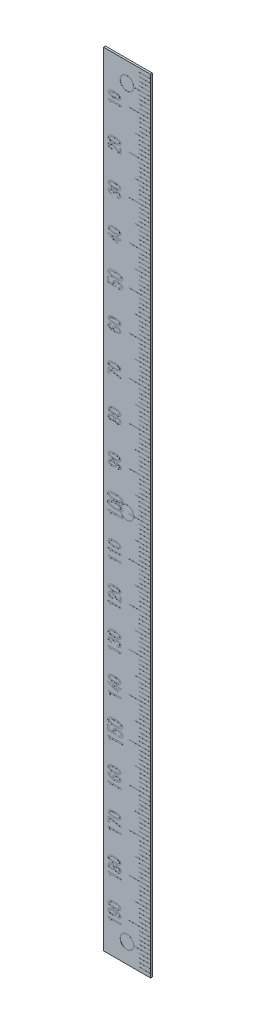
SolidWorks part; units mm, degrees
ref_plane "Front" through (0, 0, 0) normal (0, 0, 1) x (1, 0, 0)
ref_plane "Top" through (0, 0, 0) normal (0, 1, 0) x (1, 0, 0)
ref_plane "Right" through (0, 0, 0) normal (1, 0, 0) x (0, 0, -1)
sketch "Sketch1" plane through (0, 0, 0) normal (0, 0, 1) x (1, 0, 0)
  line L1 (0, 0) -> (0, 200)
  line L2 (0, 0) -> (12, 0)
  line L3 (12, 0) -> (12, 200)
  line L4 (0, 200) -> (12, 200)
  dimension "D1" = 200
  dimension "D2" = 12
extrude "Extrude1" add sketch "Sketch1" along normal blind 0.5
sketch "Sketch2" plane through (0, 0, 0.5) normal (0, 0, 1) x (1, 0, 0)
  line L0 (0, 200) -> (0, 0) construction
  line L1 (0, 0) -> (12, 0) construction
  line L2 (12, 200) -> (0, 200) construction
  circle A0 centre (6, 5) radius 1.75
  circle A1 centre (6, 195) radius 1.75
  circle A2 centre (6, 5) radius 1.65
  circle A3 centre (6, 195) radius 1.65
  circle A4 centre (6, 100) radius 1.75
  circle A5 centre (6, 100) radius 1.65
  dimension "D1" = 6
  dimension "D2" = 6
  dimension "D3" = 5
  dimension "D4" = 5
  dimension "D5" = 3.5
  dimension "D6" = 3.5
  dimension "D7" = 0.1
  dimension "D8" = 2
extrude "Extrude2" cut sketch "Sketch2" against normal blind 0.01
sketch "Sketch3" plane through (0, 0, 0.5) normal (0, 0, 1) x (1, 0, 0)
  line L0 (12, 200) -> (0, 200) construction
  line L1 (1, 188.25) -> (4.5, 188.25) construction
  line L2 (1, 188.25) -> (1, 191.75) construction
  line L3 (1, 191.75) -> (4.5, 191.75) construction
  line L4 (4.5, 188.25) -> (4.5, 191.75) construction
  line L5 (0, 200) -> (0, 0) construction
  line L6 (4.5, 178.25) -> (4.5, 181.75) construction
  line L7 (4.5, 168.25) -> (4.5, 171.75) construction
  line L8 (4.5, 158.25) -> (4.5, 161.75) construction
  line L9 (5, 148.25) -> (5, 151.75) construction
  line L10 (4.5, 138.25) -> (4.5, 141.75) construction
  line L11 (4.5, 128.25) -> (4.5, 131.75) construction
  line L12 (4.5, 118.25) -> (4.5, 121.75) construction
  line L13 (4.5, 108.25) -> (4.5, 111.75) construction
  line L14 (5, 47.2) -> (5, 52.8) construction
  line L15 (4.5, 37.2) -> (4.5, 42.8) construction
  line L16 (12, 0) -> (12, 200) construction
  line L17 (5, 50) -> (-4.9003, 50) construction
  line L18 (4.5, 27.2) -> (4.5, 32.8) construction
  line L19 (4.5, 17.2) -> (4.5, 22.8) construction
  line L20 (4.5, 7.2) -> (4.5, 12.8) construction
  line L21 (5, 97.2) -> (5, 102.8) construction
  line L23 (4.5, 87.2) -> (4.5, 92.8) construction
  line L24 (4.5, 57.2) -> (4.5, 62.8) construction
  line L25 (4.5, 67.2) -> (4.5, 72.8) construction
  line L26 (4.5, 77.2) -> (4.5, 82.8) construction
  text T0 "10" font "ＭＳ ゴシック" height in points 11
  text T1 "20" font "ＭＳ ゴシック" height in points 11
  text T2 "30" font "ＭＳ ゴシック" height in points 11
  text T3 "40" font "ＭＳ ゴシック" height in points 11
  text T4 "50" font "ＭＳ ゴシック" height in points 13
  text T5 "60  " font "ＭＳ ゴシック" height in points 11
  text T6 "70" font "ＭＳ ゴシック" height in points 11
  text T7 "80" font "ＭＳ ゴシック" height in points 11
  text T8 "90" font "ＭＳ ゴシック" height in points 11
  text T9 "150" font "ＭＳ ゴシック" height in points 13
  text T10 "160" font "ＭＳ ゴシック" height in points 11
  text T11 "170" font "ＭＳ ゴシック" height in points 11
  text T12 "180" font "ＭＳ ゴシック" height in points 11
  text T13 "190" font "ＭＳ ゴシック" height in points 11
  text T14 "100" font "ＭＳ ゴシック" height in points 13
  text T15 "110" font "ＭＳ ゴシック" height in points 11
  text T16 "120" font "ＭＳ ゴシック" height in points 11
  text T17 "130" font "ＭＳ ゴシック" height in points 11
  text T18 "140" font "ＭＳ ゴシック" height in points 11
  point P4 (4.5, 190)
  dimension "D1" = 3.5
  dimension "D2" = 10
  dimension "D3" = 1
  dimension "D4" = 3.5
  dimension "D8" = 5.6
  dimension "D6" = 7
  dimension "D7" = 7
  dimension "D9" = 7
  dimension "D5" = 4
  dimension "D11" = 2
extrude "Extrude3" cut sketch "Sketch3" against normal blind 0.01
sketch "Sketch4" plane through (0, 0, 0.5) normal (0, 0, 1) x (1, 0, 0)
  line L0 (12, 190.05) -> (6.5, 190.05)
  line L1 (12, 0) -> (12, 200) construction
  line L2 (6.5, 190.05) -> (6.5, 189.95)
  line L3 (6.5, 189.95) -> (12, 189.95)
  line L4 (12, 189.95) -> (12, 190.05)
  line L5 (12, 200) -> (0, 200) construction
  line L6 (12, 198.05) -> (12, 197.95)
  line L7 (12, 194.95) -> (8, 194.95)
  line L8 (12, 194.95) -> (12, 195.05)
  line L9 (12, 195.05) -> (8, 195.05)
  line L10 (8, 194.95) -> (8, 195.05)
  line L11 (12, 199.05) -> (9, 199.05)
  line L12 (12, 199.05) -> (12, 198.95)
  line L13 (12, 198.95) -> (9, 198.95)
  line L14 (9, 199.05) -> (9, 198.95)
  line L15 (12, 198.05) -> (9, 198.05)
  line L16 (12, 197.95) -> (9, 197.95)
  line L17 (9, 198.05) -> (9, 197.95)
  line L18 (12, 197.05) -> (12, 196.95)
  line L19 (12, 197.05) -> (9, 197.05)
  line L20 (12, 196.95) -> (9, 196.95)
  line L21 (9, 197.05) -> (9, 196.95)
  line L22 (12, 196.05) -> (12, 195.95)
  line L23 (12, 196.05) -> (9, 196.05)
  line L24 (12, 195.95) -> (9, 195.95)
  line L25 (9, 196.05) -> (9, 195.95)
  line L26 (12, 180.05) -> (6.5, 180.05)
  line L27 (6.5, 180.05) -> (6.5, 179.95)
  line L28 (6.5, 179.95) -> (12, 179.95)
  line L29 (12, 179.95) -> (12, 180.05)
  line L30 (12, 194.05) -> (12, 193.95)
  line L31 (12, 194.05) -> (9, 194.05)
  line L32 (12, 193.95) -> (9, 193.95)
  line L33 (9, 194.05) -> (9, 193.95)
  line L34 (12, 193.05) -> (12, 192.95)
  line L35 (12, 193.05) -> (9, 193.05)
  line L36 (12, 192.95) -> (9, 192.95)
  line L37 (9, 193.05) -> (9, 192.95)
  line L38 (12, 192.05) -> (12, 191.95)
  line L39 (12, 192.05) -> (9, 192.05)
  line L40 (12, 191.95) -> (9, 191.95)
  line L41 (9, 192.05) -> (9, 191.95)
  line L42 (12, 191.05) -> (12, 190.95)
  line L43 (12, 191.05) -> (9, 191.05)
  line L44 (12, 190.95) -> (9, 190.95)
  line L45 (9, 191.05) -> (9, 190.95)
  line L46 (9, 195.05) -> (9, 194.95)
  line L47 (12, 195.05) -> (9, 195.05)
  line L48 (12, 194.95) -> (9, 194.95)
  line L49 (12, 195.05) -> (12, 194.95)
  line L50 (12, 188.05) -> (12, 187.95)
  line L51 (12, 184.95) -> (8, 184.95)
  line L52 (12, 184.95) -> (12, 185.05)
  line L53 (12, 185.05) -> (8, 185.05)
  line L54 (8, 184.95) -> (8, 185.05)
  line L55 (12, 189.05) -> (9, 189.05)
  line L56 (12, 189.05) -> (12, 188.95)
  line L57 (12, 188.95) -> (9, 188.95)
  line L58 (9, 189.05) -> (9, 188.95)
  line L59 (12, 188.05) -> (9, 188.05)
  line L60 (12, 187.95) -> (9, 187.95)
  line L61 (9, 188.05) -> (9, 187.95)
  line L62 (12, 187.05) -> (12, 186.95)
  line L63 (12, 187.05) -> (9, 187.05)
  line L64 (12, 186.95) -> (9, 186.95)
  line L65 (9, 187.05) -> (9, 186.95)
  line L66 (12, 186.05) -> (12, 185.95)
  line L67 (12, 186.05) -> (9, 186.05)
  line L68 (12, 185.95) -> (9, 185.95)
  line L69 (9, 186.05) -> (9, 185.95)
  line L70 (12, 184.05) -> (12, 183.95)
  line L71 (12, 184.05) -> (9, 184.05)
  line L72 (12, 183.95) -> (9, 183.95)
  line L73 (9, 184.05) -> (9, 183.95)
  line L74 (12, 183.05) -> (12, 182.95)
  line L75 (12, 183.05) -> (9, 183.05)
  line L76 (12, 182.95) -> (9, 182.95)
  line L77 (9, 183.05) -> (9, 182.95)
  line L78 (12, 182.05) -> (12, 181.95)
  line L79 (12, 182.05) -> (9, 182.05)
  line L80 (12, 181.95) -> (9, 181.95)
  line L81 (9, 182.05) -> (9, 181.95)
  line L82 (12, 181.05) -> (12, 180.95)
  line L83 (12, 181.05) -> (9, 181.05)
  line L84 (12, 180.95) -> (9, 180.95)
  line L85 (9, 181.05) -> (9, 180.95)
  line L86 (12, 170.05) -> (6.5, 170.05)
  line L87 (6.5, 170.05) -> (6.5, 169.95)
  line L88 (6.5, 169.95) -> (12, 169.95)
  line L89 (12, 169.95) -> (12, 170.05)
  line L90 (12, 178.05) -> (12, 177.95)
  line L91 (12, 174.95) -> (8, 174.95)
  line L92 (12, 174.95) -> (12, 175.05)
  line L93 (12, 175.05) -> (8, 175.05)
  line L94 (8, 174.95) -> (8, 175.05)
  line L95 (12, 179.05) -> (9, 179.05)
  line L96 (12, 179.05) -> (12, 178.95)
  line L97 (12, 178.95) -> (9, 178.95)
  line L98 (9, 179.05) -> (9, 178.95)
  line L99 (12, 178.05) -> (9, 178.05)
  line L100 (12, 177.95) -> (9, 177.95)
  line L101 (9, 178.05) -> (9, 177.95)
  line L102 (12, 177.05) -> (12, 176.95)
  line L103 (12, 177.05) -> (9, 177.05)
  line L104 (12, 176.95) -> (9, 176.95)
  line L105 (9, 177.05) -> (9, 176.95)
  line L106 (12, 176.05) -> (12, 175.95)
  line L107 (12, 176.05) -> (9, 176.05)
  line L108 (12, 175.95) -> (9, 175.95)
  line L109 (9, 176.05) -> (9, 175.95)
  line L110 (12, 174.05) -> (12, 173.95)
  line L111 (12, 174.05) -> (9, 174.05)
  line L112 (12, 173.95) -> (9, 173.95)
  line L113 (9, 174.05) -> (9, 173.95)
  line L114 (12, 173.05) -> (12, 172.95)
  line L115 (12, 173.05) -> (9, 173.05)
  line L116 (12, 172.95) -> (9, 172.95)
  line L117 (9, 173.05) -> (9, 172.95)
  line L118 (12, 172.05) -> (12, 171.95)
  line L119 (12, 172.05) -> (9, 172.05)
  line L120 (12, 171.95) -> (9, 171.95)
  line L121 (9, 172.05) -> (9, 171.95)
  line L122 (12, 171.05) -> (12, 170.95)
  line L123 (12, 171.05) -> (9, 171.05)
  line L124 (12, 170.95) -> (9, 170.95)
  line L125 (9, 171.05) -> (9, 170.95)
  line L126 (12, 160.05) -> (6.5, 160.05)
  line L127 (6.5, 160.05) -> (6.5, 159.95)
  line L128 (6.5, 159.95) -> (12, 159.95)
  line L129 (12, 159.95) -> (12, 160.05)
  line L130 (12, 168.05) -> (12, 167.95)
  line L131 (12, 164.95) -> (8, 164.95)
  line L132 (12, 164.95) -> (12, 165.05)
  line L133 (12, 165.05) -> (8, 165.05)
  line L134 (8, 164.95) -> (8, 165.05)
  line L135 (12, 169.05) -> (9, 169.05)
  line L136 (12, 169.05) -> (12, 168.95)
  line L137 (12, 168.95) -> (9, 168.95)
  line L138 (9, 169.05) -> (9, 168.95)
  line L139 (12, 168.05) -> (9, 168.05)
  line L140 (12, 167.95) -> (9, 167.95)
  line L141 (9, 168.05) -> (9, 167.95)
  line L142 (12, 167.05) -> (12, 166.95)
  line L143 (12, 167.05) -> (9, 167.05)
  line L144 (12, 166.95) -> (9, 166.95)
  line L145 (9, 167.05) -> (9, 166.95)
  line L146 (12, 166.05) -> (12, 165.95)
  line L147 (12, 166.05) -> (9, 166.05)
  line L148 (12, 165.95) -> (9, 165.95)
  line L149 (9, 166.05) -> (9, 165.95)
  line L150 (12, 164.05) -> (12, 163.95)
  line L151 (12, 164.05) -> (9, 164.05)
  line L152 (12, 163.95) -> (9, 163.95)
  line L153 (9, 164.05) -> (9, 163.95)
  line L154 (12, 163.05) -> (12, 162.95)
  line L155 (12, 163.05) -> (9, 163.05)
  line L156 (12, 162.95) -> (9, 162.95)
  line L157 (9, 163.05) -> (9, 162.95)
  line L158 (12, 162.05) -> (12, 161.95)
  line L159 (12, 162.05) -> (9, 162.05)
  line L160 (12, 161.95) -> (9, 161.95)
  line L161 (9, 162.05) -> (9, 161.95)
  line L162 (12, 161.05) -> (12, 160.95)
  line L163 (12, 161.05) -> (9, 161.05)
  line L164 (12, 160.95) -> (9, 160.95)
  line L165 (9, 161.05) -> (9, 160.95)
  line L166 (12, 150.05) -> (6.5, 150.05)
  line L167 (6.5, 150.05) -> (6.5, 149.95)
  line L168 (6.5, 149.95) -> (12, 149.95)
  line L169 (12, 149.95) -> (12, 150.05)
  line L170 (12, 158.05) -> (12, 157.95)
  line L171 (12, 154.95) -> (8, 154.95)
  line L172 (12, 154.95) -> (12, 155.05)
  line L173 (12, 155.05) -> (8, 155.05)
  line L174 (8, 154.95) -> (8, 155.05)
  line L175 (12, 159.05) -> (9, 159.05)
  line L176 (12, 159.05) -> (12, 158.95)
  line L177 (12, 158.95) -> (9, 158.95)
  line L178 (9, 159.05) -> (9, 158.95)
  line L179 (12, 158.05) -> (9, 158.05)
  line L180 (12, 157.95) -> (9, 157.95)
  line L181 (9, 158.05) -> (9, 157.95)
  line L182 (12, 157.05) -> (12, 156.95)
  line L183 (12, 157.05) -> (9, 157.05)
  line L184 (12, 156.95) -> (9, 156.95)
  line L185 (9, 157.05) -> (9, 156.95)
  line L186 (12, 156.05) -> (12, 155.95)
  line L187 (12, 156.05) -> (9, 156.05)
  line L188 (12, 155.95) -> (9, 155.95)
  line L189 (9, 156.05) -> (9, 155.95)
  line L190 (12, 154.05) -> (12, 153.95)
  line L191 (12, 154.05) -> (9, 154.05)
  line L192 (12, 153.95) -> (9, 153.95)
  line L193 (9, 154.05) -> (9, 153.95)
  line L194 (12, 153.05) -> (12, 152.95)
  line L195 (12, 153.05) -> (9, 153.05)
  line L196 (12, 152.95) -> (9, 152.95)
  line L197 (9, 153.05) -> (9, 152.95)
  line L198 (12, 152.05) -> (12, 151.95)
  line L199 (12, 152.05) -> (9, 152.05)
  line L200 (12, 151.95) -> (9, 151.95)
  line L201 (9, 152.05) -> (9, 151.95)
  line L202 (12, 151.05) -> (12, 150.95)
  line L203 (12, 151.05) -> (9, 151.05)
  line L204 (12, 150.95) -> (9, 150.95)
  line L205 (9, 151.05) -> (9, 150.95)
  line L206 (12, 150.05) -> (6.5, 150.05)
  line L207 (6.5, 150.05) -> (6.5, 149.95)
  line L208 (6.5, 149.95) -> (12, 149.95)
  line L209 (12, 149.95) -> (12, 150.05)
  line L210 (12, 148.05) -> (12, 147.95)
  line L211 (12, 144.95) -> (8, 144.95)
  line L212 (12, 144.95) -> (12, 145.05)
  line L213 (12, 145.05) -> (8, 145.05)
  line L214 (8, 144.95) -> (8, 145.05)
  line L215 (12, 149.05) -> (9, 149.05)
  line L216 (12, 149.05) -> (12, 148.95)
  line L217 (12, 148.95) -> (9, 148.95)
  line L218 (9, 149.05) -> (9, 148.95)
  line L219 (12, 148.05) -> (9, 148.05)
  line L220 (12, 147.95) -> (9, 147.95)
  line L221 (9, 148.05) -> (9, 147.95)
  line L222 (12, 147.05) -> (12, 146.95)
  line L223 (12, 147.05) -> (9, 147.05)
  line L224 (12, 146.95) -> (9, 146.95)
  line L225 (9, 147.05) -> (9, 146.95)
  line L226 (12, 146.05) -> (12, 145.95)
  line L227 (12, 146.05) -> (9, 146.05)
  line L228 (12, 145.95) -> (9, 145.95)
  line L229 (9, 146.05) -> (9, 145.95)
  line L230 (12, 144.05) -> (12, 143.95)
  line L231 (12, 144.05) -> (9, 144.05)
  line L232 (12, 143.95) -> (9, 143.95)
  line L233 (9, 144.05) -> (9, 143.95)
  line L234 (12, 143.05) -> (12, 142.95)
  line L235 (12, 143.05) -> (9, 143.05)
  line L236 (12, 142.95) -> (9, 142.95)
  line L237 (9, 143.05) -> (9, 142.95)
  line L238 (12, 142.05) -> (12, 141.95)
  line L239 (12, 142.05) -> (9, 142.05)
  line L240 (12, 141.95) -> (9, 141.95)
  line L241 (9, 142.05) -> (9, 141.95)
  line L242 (12, 141.05) -> (12, 140.95)
  line L243 (12, 141.05) -> (9, 141.05)
  line L244 (12, 140.95) -> (9, 140.95)
  line L245 (9, 141.05) -> (9, 140.95)
  line L246 (12, 140.05) -> (6.5, 140.05)
  line L247 (6.5, 140.05) -> (6.5, 139.95)
  line L248 (6.5, 139.95) -> (12, 139.95)
  line L249 (12, 139.95) -> (12, 140.05)
  line L250 (12, 138.05) -> (12, 137.95)
  line L251 (12, 134.95) -> (8, 134.95)
  line L252 (12, 134.95) -> (12, 135.05)
  line L253 (12, 135.05) -> (8, 135.05)
  line L254 (8, 134.95) -> (8, 135.05)
  line L255 (12, 139.05) -> (9, 139.05)
  line L256 (12, 139.05) -> (12, 138.95)
  line L257 (12, 138.95) -> (9, 138.95)
  line L258 (9, 139.05) -> (9, 138.95)
  line L259 (12, 138.05) -> (9, 138.05)
  line L260 (12, 137.95) -> (9, 137.95)
  line L261 (9, 138.05) -> (9, 137.95)
  line L262 (12, 137.05) -> (12, 136.95)
  line L263 (12, 137.05) -> (9, 137.05)
  line L264 (12, 136.95) -> (9, 136.95)
  line L265 (9, 137.05) -> (9, 136.95)
  line L266 (12, 136.05) -> (12, 135.95)
  line L267 (12, 136.05) -> (9, 136.05)
  line L268 (12, 135.95) -> (9, 135.95)
  line L269 (9, 136.05) -> (9, 135.95)
  line L270 (12, 134.05) -> (12, 133.95)
  line L271 (12, 134.05) -> (9, 134.05)
  line L272 (12, 133.95) -> (9, 133.95)
  line L273 (9, 134.05) -> (9, 133.95)
  line L274 (12, 133.05) -> (12, 132.95)
  line L275 (12, 133.05) -> (9, 133.05)
  line L276 (12, 132.95) -> (9, 132.95)
  line L277 (9, 133.05) -> (9, 132.95)
  line L278 (12, 132.05) -> (12, 131.95)
  line L279 (12, 132.05) -> (9, 132.05)
  line L280 (12, 131.95) -> (9, 131.95)
  line L281 (9, 132.05) -> (9, 131.95)
  line L282 (12, 131.05) -> (12, 130.95)
  line L283 (12, 131.05) -> (9, 131.05)
  line L284 (12, 130.95) -> (9, 130.95)
  line L285 (9, 131.05) -> (9, 130.95)
  line L286 (12, 130.05) -> (6.5, 130.05)
  line L287 (6.5, 130.05) -> (6.5, 129.95)
  line L288 (6.5, 129.95) -> (12, 129.95)
  line L289 (12, 129.95) -> (12, 130.05)
  line L290 (12, 128.05) -> (12, 127.95)
  line L291 (12, 124.95) -> (8, 124.95)
  line L292 (12, 124.95) -> (12, 125.05)
  line L293 (12, 125.05) -> (8, 125.05)
  line L294 (8, 124.95) -> (8, 125.05)
  line L295 (12, 129.05) -> (9, 129.05)
  line L296 (12, 129.05) -> (12, 128.95)
  line L297 (12, 128.95) -> (9, 128.95)
  line L298 (9, 129.05) -> (9, 128.95)
  line L299 (12, 128.05) -> (9, 128.05)
  line L300 (12, 127.95) -> (9, 127.95)
  line L301 (9, 128.05) -> (9, 127.95)
  line L302 (12, 127.05) -> (12, 126.95)
  line L303 (12, 127.05) -> (9, 127.05)
  line L304 (12, 126.95) -> (9, 126.95)
  line L305 (9, 127.05) -> (9, 126.95)
  line L306 (12, 126.05) -> (12, 125.95)
  line L307 (12, 126.05) -> (9, 126.05)
  line L308 (12, 125.95) -> (9, 125.95)
  line L309 (9, 126.05) -> (9, 125.95)
  line L310 (12, 124.05) -> (12, 123.95)
  line L311 (12, 124.05) -> (9, 124.05)
  line L312 (12, 123.95) -> (9, 123.95)
  line L313 (9, 124.05) -> (9, 123.95)
  line L314 (12, 123.05) -> (12, 122.95)
  line L315 (12, 123.05) -> (9, 123.05)
  line L316 (12, 122.95) -> (9, 122.95)
  line L317 (9, 123.05) -> (9, 122.95)
  line L318 (12, 122.05) -> (12, 121.95)
  line L319 (12, 122.05) -> (9, 122.05)
  line L320 (12, 121.95) -> (9, 121.95)
  line L321 (9, 122.05) -> (9, 121.95)
  line L322 (12, 121.05) -> (12, 120.95)
  line L323 (12, 121.05) -> (9, 121.05)
  line L324 (12, 120.95) -> (9, 120.95)
  line L325 (9, 121.05) -> (9, 120.95)
  line L326 (12, 120.05) -> (6.5, 120.05)
  line L327 (6.5, 120.05) -> (6.5, 119.95)
  line L328 (6.5, 119.95) -> (12, 119.95)
  line L329 (12, 119.95) -> (12, 120.05)
  line L330 (12, 118.05) -> (12, 117.95)
  line L331 (12, 114.95) -> (8, 114.95)
  line L332 (12, 114.95) -> (12, 115.05)
  line L333 (12, 115.05) -> (8, 115.05)
  line L334 (8, 114.95) -> (8, 115.05)
  line L335 (12, 119.05) -> (9, 119.05)
  line L336 (12, 119.05) -> (12, 118.95)
  line L337 (12, 118.95) -> (9, 118.95)
  line L338 (9, 119.05) -> (9, 118.95)
  line L339 (12, 118.05) -> (9, 118.05)
  line L340 (12, 117.95) -> (9, 117.95)
  line L341 (9, 118.05) -> (9, 117.95)
  line L342 (12, 117.05) -> (12, 116.95)
  line L343 (12, 117.05) -> (9, 117.05)
  line L344 (12, 116.95) -> (9, 116.95)
  line L345 (9, 117.05) -> (9, 116.95)
  line L346 (12, 116.05) -> (12, 115.95)
  line L347 (12, 116.05) -> (9, 116.05)
  line L348 (12, 115.95) -> (9, 115.95)
  line L349 (9, 116.05) -> (9, 115.95)
  line L350 (12, 114.05) -> (12, 113.95)
  line L351 (12, 114.05) -> (9, 114.05)
  line L352 (12, 113.95) -> (9, 113.95)
  line L353 (9, 114.05) -> (9, 113.95)
  line L354 (12, 113.05) -> (12, 112.95)
  line L355 (12, 113.05) -> (9, 113.05)
  line L356 (12, 112.95) -> (9, 112.95)
  line L357 (9, 113.05) -> (9, 112.95)
  line L358 (12, 112.05) -> (12, 111.95)
  line L359 (12, 112.05) -> (9, 112.05)
  line L360 (12, 111.95) -> (9, 111.95)
  line L361 (9, 112.05) -> (9, 111.95)
  line L362 (12, 111.05) -> (12, 110.95)
  line L363 (12, 111.05) -> (9, 111.05)
  line L364 (12, 110.95) -> (9, 110.95)
  line L365 (9, 111.05) -> (9, 110.95)
  line L366 (12, 110.05) -> (6.5, 110.05)
  line L367 (6.5, 110.05) -> (6.5, 109.95)
  line L368 (6.5, 109.95) -> (12, 109.95)
  line L369 (12, 109.95) -> (12, 110.05)
  line L370 (12, 108.05) -> (12, 107.95)
  line L371 (12, 104.95) -> (8, 104.95)
  line L372 (12, 104.95) -> (12, 105.05)
  line L373 (12, 105.05) -> (8, 105.05)
  line L374 (8, 104.95) -> (8, 105.05)
  line L375 (12, 109.05) -> (9, 109.05)
  line L376 (12, 109.05) -> (12, 108.95)
  line L377 (12, 108.95) -> (9, 108.95)
  line L378 (9, 109.05) -> (9, 108.95)
  line L379 (12, 108.05) -> (9, 108.05)
  line L380 (12, 107.95) -> (9, 107.95)
  line L381 (9, 108.05) -> (9, 107.95)
  line L382 (12, 107.05) -> (12, 106.95)
  line L383 (12, 107.05) -> (9, 107.05)
  line L384 (12, 106.95) -> (9, 106.95)
  line L385 (9, 107.05) -> (9, 106.95)
  line L386 (12, 106.05) -> (12, 105.95)
  line L387 (12, 106.05) -> (9, 106.05)
  line L388 (12, 105.95) -> (9, 105.95)
  line L389 (9, 106.05) -> (9, 105.95)
  line L390 (12, 104.05) -> (12, 103.95)
  line L391 (12, 104.05) -> (9, 104.05)
  line L392 (12, 103.95) -> (9, 103.95)
  line L393 (9, 104.05) -> (9, 103.95)
  line L394 (12, 103.05) -> (12, 102.95)
  line L395 (12, 103.05) -> (9, 103.05)
  line L396 (12, 102.95) -> (9, 102.95)
  line L397 (9, 103.05) -> (9, 102.95)
  line L398 (12, 102.05) -> (12, 101.95)
  line L399 (12, 102.05) -> (9, 102.05)
  line L400 (12, 101.95) -> (9, 101.95)
  line L401 (9, 102.05) -> (9, 101.95)
  line L402 (12, 101.05) -> (12, 100.95)
  line L403 (12, 101.05) -> (9, 101.05)
  line L404 (12, 100.95) -> (9, 100.95)
  line L405 (9, 101.05) -> (9, 100.95)
  line L406 (12, 100.05) -> (6.5, 100.05)
  line L407 (6.5, 100.05) -> (6.5, 99.95)
  line L408 (6.5, 99.95) -> (12, 99.95)
  line L409 (12, 99.95) -> (12, 100.05)
  line L410 (12, 98.05) -> (12, 97.95)
  line L411 (12, 94.95) -> (8, 94.95)
  line L412 (12, 94.95) -> (12, 95.05)
  line L413 (12, 95.05) -> (8, 95.05)
  line L414 (8, 94.95) -> (8, 95.05)
  line L415 (12, 99.05) -> (9, 99.05)
  line L416 (12, 99.05) -> (12, 98.95)
  line L417 (12, 98.95) -> (9, 98.95)
  line L418 (9, 99.05) -> (9, 98.95)
  line L419 (12, 98.05) -> (9, 98.05)
  line L420 (12, 97.95) -> (9, 97.95)
  line L421 (9, 98.05) -> (9, 97.95)
  line L422 (12, 97.05) -> (12, 96.95)
  line L423 (12, 97.05) -> (9, 97.05)
  line L424 (12, 96.95) -> (9, 96.95)
  line L425 (9, 97.05) -> (9, 96.95)
  line L426 (12, 96.05) -> (12, 95.95)
  line L427 (12, 96.05) -> (9, 96.05)
  line L428 (12, 95.95) -> (9, 95.95)
  line L429 (9, 96.05) -> (9, 95.95)
  line L430 (12, 94.05) -> (12, 93.95)
  line L431 (12, 94.05) -> (9, 94.05)
  line L432 (12, 93.95) -> (9, 93.95)
  line L433 (9, 94.05) -> (9, 93.95)
  line L434 (12, 93.05) -> (12, 92.95)
  line L435 (12, 93.05) -> (9, 93.05)
  line L436 (12, 92.95) -> (9, 92.95)
  line L437 (9, 93.05) -> (9, 92.95)
  line L438 (12, 92.05) -> (12, 91.95)
  line L439 (12, 92.05) -> (9, 92.05)
  line L440 (12, 91.95) -> (9, 91.95)
  line L441 (9, 92.05) -> (9, 91.95)
  line L442 (12, 91.05) -> (12, 90.95)
  line L443 (12, 91.05) -> (9, 91.05)
  line L444 (12, 90.95) -> (9, 90.95)
  line L445 (9, 91.05) -> (9, 90.95)
  line L446 (12, 90.05) -> (6.5, 90.05)
  line L447 (6.5, 90.05) -> (6.5, 89.95)
  line L448 (6.5, 89.95) -> (12, 89.95)
  line L449 (12, 89.95) -> (12, 90.05)
  line L450 (12, 88.05) -> (12, 87.95)
  line L451 (12, 84.95) -> (8, 84.95)
  line L452 (12, 84.95) -> (12, 85.05)
  line L453 (12, 85.05) -> (8, 85.05)
  line L454 (8, 84.95) -> (8, 85.05)
  line L455 (12, 89.05) -> (9, 89.05)
  line L456 (12, 89.05) -> (12, 88.95)
  line L457 (12, 88.95) -> (9, 88.95)
  line L458 (9, 89.05) -> (9, 88.95)
  line L459 (12, 88.05) -> (9, 88.05)
  line L460 (12, 87.95) -> (9, 87.95)
  line L461 (9, 88.05) -> (9, 87.95)
  line L462 (12, 87.05) -> (12, 86.95)
  line L463 (12, 87.05) -> (9, 87.05)
  line L464 (12, 86.95) -> (9, 86.95)
  line L465 (9, 87.05) -> (9, 86.95)
  line L466 (12, 86.05) -> (12, 85.95)
  line L467 (12, 86.05) -> (9, 86.05)
  line L468 (12, 85.95) -> (9, 85.95)
  line L469 (9, 86.05) -> (9, 85.95)
  line L470 (12, 84.05) -> (12, 83.95)
  line L471 (12, 84.05) -> (9, 84.05)
  line L472 (12, 83.95) -> (9, 83.95)
  line L473 (9, 84.05) -> (9, 83.95)
  line L474 (12, 83.05) -> (12, 82.95)
  line L475 (12, 83.05) -> (9, 83.05)
  line L476 (12, 82.95) -> (9, 82.95)
  line L477 (9, 83.05) -> (9, 82.95)
  line L478 (12, 82.05) -> (12, 81.95)
  line L479 (12, 82.05) -> (9, 82.05)
  line L480 (12, 81.95) -> (9, 81.95)
  line L481 (9, 82.05) -> (9, 81.95)
  line L482 (12, 81.05) -> (12, 80.95)
  line L483 (12, 81.05) -> (9, 81.05)
  line L484 (12, 80.95) -> (9, 80.95)
  line L485 (9, 81.05) -> (9, 80.95)
  line L486 (12, 80.05) -> (6.5, 80.05)
  line L487 (6.5, 80.05) -> (6.5, 79.95)
  line L488 (6.5, 79.95) -> (12, 79.95)
  line L489 (12, 79.95) -> (12, 80.05)
  line L490 (12, 78.05) -> (12, 77.95)
  line L491 (12, 74.95) -> (8, 74.95)
  line L492 (12, 74.95) -> (12, 75.05)
  line L493 (12, 75.05) -> (8, 75.05)
  line L494 (8, 74.95) -> (8, 75.05)
  line L495 (12, 79.05) -> (9, 79.05)
  line L496 (12, 79.05) -> (12, 78.95)
  line L497 (12, 78.95) -> (9, 78.95)
  line L498 (9, 79.05) -> (9, 78.95)
  line L499 (12, 78.05) -> (9, 78.05)
  line L500 (12, 77.95) -> (9, 77.95)
  line L501 (9, 78.05) -> (9, 77.95)
  line L502 (12, 77.05) -> (12, 76.95)
  line L503 (12, 77.05) -> (9, 77.05)
  line L504 (12, 76.95) -> (9, 76.95)
  line L505 (9, 77.05) -> (9, 76.95)
  line L506 (12, 76.05) -> (12, 75.95)
  line L507 (12, 76.05) -> (9, 76.05)
  line L508 (12, 75.95) -> (9, 75.95)
  line L509 (9, 76.05) -> (9, 75.95)
  line L510 (12, 74.05) -> (12, 73.95)
  line L511 (12, 74.05) -> (9, 74.05)
  line L512 (12, 73.95) -> (9, 73.95)
  line L513 (9, 74.05) -> (9, 73.95)
  line L514 (12, 73.05) -> (12, 72.95)
  line L515 (12, 73.05) -> (9, 73.05)
  line L516 (12, 72.95) -> (9, 72.95)
  line L517 (9, 73.05) -> (9, 72.95)
  line L518 (12, 72.05) -> (12, 71.95)
  line L519 (12, 72.05) -> (9, 72.05)
  line L520 (12, 71.95) -> (9, 71.95)
  line L521 (9, 72.05) -> (9, 71.95)
  line L522 (12, 71.05) -> (12, 70.95)
  line L523 (12, 71.05) -> (9, 71.05)
  line L524 (12, 70.95) -> (9, 70.95)
  line L525 (9, 71.05) -> (9, 70.95)
  line L526 (12, 70.05) -> (6.5, 70.05)
  line L527 (6.5, 70.05) -> (6.5, 69.95)
  line L528 (6.5, 69.95) -> (12, 69.95)
  line L529 (12, 69.95) -> (12, 70.05)
  line L530 (12, 68.05) -> (12, 67.95)
  line L531 (12, 64.95) -> (8, 64.95)
  line L532 (12, 64.95) -> (12, 65.05)
  line L533 (12, 65.05) -> (8, 65.05)
  line L534 (8, 64.95) -> (8, 65.05)
  line L535 (12, 69.05) -> (9, 69.05)
  line L536 (12, 69.05) -> (12, 68.95)
  line L537 (12, 68.95) -> (9, 68.95)
  line L538 (9, 69.05) -> (9, 68.95)
  line L539 (12, 68.05) -> (9, 68.05)
  line L540 (12, 67.95) -> (9, 67.95)
  line L541 (9, 68.05) -> (9, 67.95)
  line L542 (12, 67.05) -> (12, 66.95)
  line L543 (12, 67.05) -> (9, 67.05)
  line L544 (12, 66.95) -> (9, 66.95)
  line L545 (9, 67.05) -> (9, 66.95)
  line L546 (12, 66.05) -> (12, 65.95)
  line L547 (12, 66.05) -> (9, 66.05)
  line L548 (12, 65.95) -> (9, 65.95)
  line L549 (9, 66.05) -> (9, 65.95)
  line L550 (12, 64.05) -> (12, 63.95)
  line L551 (12, 64.05) -> (9, 64.05)
  line L552 (12, 63.95) -> (9, 63.95)
  line L553 (9, 64.05) -> (9, 63.95)
  line L554 (12, 63.05) -> (12, 62.95)
  line L555 (12, 63.05) -> (9, 63.05)
  line L556 (12, 62.95) -> (9, 62.95)
  line L557 (9, 63.05) -> (9, 62.95)
  line L558 (12, 62.05) -> (12, 61.95)
  line L559 (12, 62.05) -> (9, 62.05)
  line L560 (12, 61.95) -> (9, 61.95)
  line L561 (9, 62.05) -> (9, 61.95)
  line L562 (12, 61.05) -> (12, 60.95)
  line L563 (12, 61.05) -> (9, 61.05)
  line L564 (12, 60.95) -> (9, 60.95)
  line L565 (9, 61.05) -> (9, 60.95)
  line L566 (12, 60.05) -> (6.5, 60.05)
  line L567 (6.5, 60.05) -> (6.5, 59.95)
  line L568 (6.5, 59.95) -> (12, 59.95)
  line L569 (12, 59.95) -> (12, 60.05)
  line L570 (12, 58.05) -> (12, 57.95)
  line L571 (12, 54.95) -> (8, 54.95)
  line L572 (12, 54.95) -> (12, 55.05)
  line L573 (12, 55.05) -> (8, 55.05)
  line L574 (8, 54.95) -> (8, 55.05)
  line L575 (12, 59.05) -> (9, 59.05)
  line L576 (12, 59.05) -> (12, 58.95)
  line L577 (12, 58.95) -> (9, 58.95)
  line L578 (9, 59.05) -> (9, 58.95)
  line L579 (12, 58.05) -> (9, 58.05)
  line L580 (12, 57.95) -> (9, 57.95)
  line L581 (9, 58.05) -> (9, 57.95)
  line L582 (12, 57.05) -> (12, 56.95)
  line L583 (12, 57.05) -> (9, 57.05)
  line L584 (12, 56.95) -> (9, 56.95)
  line L585 (9, 57.05) -> (9, 56.95)
  line L586 (12, 56.05) -> (12, 55.95)
  line L587 (12, 56.05) -> (9, 56.05)
  line L588 (12, 55.95) -> (9, 55.95)
  line L589 (9, 56.05) -> (9, 55.95)
  line L590 (12, 54.05) -> (12, 53.95)
  line L591 (12, 54.05) -> (9, 54.05)
  line L592 (12, 53.95) -> (9, 53.95)
  line L593 (9, 54.05) -> (9, 53.95)
  line L594 (12, 53.05) -> (12, 52.95)
  line L595 (12, 53.05) -> (9, 53.05)
  line L596 (12, 52.95) -> (9, 52.95)
  line L597 (9, 53.05) -> (9, 52.95)
  line L598 (12, 52.05) -> (12, 51.95)
  line L599 (12, 52.05) -> (9, 52.05)
  line L600 (12, 51.95) -> (9, 51.95)
  line L601 (9, 52.05) -> (9, 51.95)
  line L602 (12, 51.05) -> (12, 50.95)
  line L603 (12, 51.05) -> (9, 51.05)
  line L604 (12, 50.95) -> (9, 50.95)
  line L605 (9, 51.05) -> (9, 50.95)
  line L606 (12, 50.05) -> (6.5, 50.05)
  line L607 (6.5, 50.05) -> (6.5, 49.95)
  line L608 (6.5, 49.95) -> (12, 49.95)
  line L609 (12, 49.95) -> (12, 50.05)
  line L610 (12, 48.05) -> (12, 47.95)
  line L611 (12, 44.95) -> (8, 44.95)
  line L612 (12, 44.95) -> (12, 45.05)
  line L613 (12, 45.05) -> (8, 45.05)
  line L614 (8, 44.95) -> (8, 45.05)
  line L615 (12, 49.05) -> (9, 49.05)
  line L616 (12, 49.05) -> (12, 48.95)
  line L617 (12, 48.95) -> (9, 48.95)
  line L618 (9, 49.05) -> (9, 48.95)
  line L619 (12, 48.05) -> (9, 48.05)
  line L620 (12, 47.95) -> (9, 47.95)
  line L621 (9, 48.05) -> (9, 47.95)
  line L622 (12, 47.05) -> (12, 46.95)
  line L623 (12, 47.05) -> (9, 47.05)
  line L624 (12, 46.95) -> (9, 46.95)
  line L625 (9, 47.05) -> (9, 46.95)
  line L626 (12, 46.05) -> (12, 45.95)
  line L627 (12, 46.05) -> (9, 46.05)
  line L628 (12, 45.95) -> (9, 45.95)
  line L629 (9, 46.05) -> (9, 45.95)
  line L630 (12, 44.05) -> (12, 43.95)
  line L631 (12, 44.05) -> (9, 44.05)
  line L632 (12, 43.95) -> (9, 43.95)
  line L633 (9, 44.05) -> (9, 43.95)
  line L634 (12, 43.05) -> (12, 42.95)
  line L635 (12, 43.05) -> (9, 43.05)
  line L636 (12, 42.95) -> (9, 42.95)
  line L637 (9, 43.05) -> (9, 42.95)
  line L638 (12, 42.05) -> (12, 41.95)
  line L639 (12, 42.05) -> (9, 42.05)
  line L640 (12, 41.95) -> (9, 41.95)
  line L641 (9, 42.05) -> (9, 41.95)
  line L642 (12, 41.05) -> (12, 40.95)
  line L643 (12, 41.05) -> (9, 41.05)
  line L644 (12, 40.95) -> (9, 40.95)
  line L645 (9, 41.05) -> (9, 40.95)
  line L646 (12, 40.05) -> (6.5, 40.05)
  line L647 (6.5, 40.05) -> (6.5, 39.95)
  line L648 (6.5, 39.95) -> (12, 39.95)
  line L649 (12, 39.95) -> (12, 40.05)
  line L650 (12, 38.05) -> (12, 37.95)
  line L651 (12, 34.95) -> (8, 34.95)
  line L652 (12, 34.95) -> (12, 35.05)
  line L653 (12, 35.05) -> (8, 35.05)
  line L654 (8, 34.95) -> (8, 35.05)
  line L655 (12, 39.05) -> (9, 39.05)
  line L656 (12, 39.05) -> (12, 38.95)
  line L657 (12, 38.95) -> (9, 38.95)
  line L658 (9, 39.05) -> (9, 38.95)
  line L659 (12, 38.05) -> (9, 38.05)
  line L660 (12, 37.95) -> (9, 37.95)
  line L661 (9, 38.05) -> (9, 37.95)
  line L662 (12, 37.05) -> (12, 36.95)
  line L663 (12, 37.05) -> (9, 37.05)
  line L664 (12, 36.95) -> (9, 36.95)
  line L665 (9, 37.05) -> (9, 36.95)
  line L666 (12, 36.05) -> (12, 35.95)
  line L667 (12, 36.05) -> (9, 36.05)
  line L668 (12, 35.95) -> (9, 35.95)
  line L669 (9, 36.05) -> (9, 35.95)
  line L670 (12, 34.05) -> (12, 33.95)
  line L671 (12, 34.05) -> (9, 34.05)
  line L672 (12, 33.95) -> (9, 33.95)
  line L673 (9, 34.05) -> (9, 33.95)
  line L674 (12, 33.05) -> (12, 32.95)
  line L675 (12, 33.05) -> (9, 33.05)
  line L676 (12, 32.95) -> (9, 32.95)
  line L677 (9, 33.05) -> (9, 32.95)
  line L678 (12, 32.05) -> (12, 31.95)
  line L679 (12, 32.05) -> (9, 32.05)
  line L680 (12, 31.95) -> (9, 31.95)
  line L681 (9, 32.05) -> (9, 31.95)
  line L682 (12, 31.05) -> (12, 30.95)
  line L683 (12, 31.05) -> (9, 31.05)
  line L684 (12, 30.95) -> (9, 30.95)
  line L685 (9, 31.05) -> (9, 30.95)
  line L686 (12, 30.05) -> (6.5, 30.05)
  line L687 (6.5, 30.05) -> (6.5, 29.95)
  line L688 (6.5, 29.95) -> (12, 29.95)
  line L689 (12, 29.95) -> (12, 30.05)
  line L690 (12, 28.05) -> (12, 27.95)
  line L691 (12, 24.95) -> (8, 24.95)
  line L692 (12, 24.95) -> (12, 25.05)
  line L693 (12, 25.05) -> (8, 25.05)
  line L694 (8, 24.95) -> (8, 25.05)
  line L695 (12, 29.05) -> (9, 29.05)
  line L696 (12, 29.05) -> (12, 28.95)
  line L697 (12, 28.95) -> (9, 28.95)
  line L698 (9, 29.05) -> (9, 28.95)
  line L699 (12, 28.05) -> (9, 28.05)
  line L700 (12, 27.95) -> (9, 27.95)
  line L701 (9, 28.05) -> (9, 27.95)
  line L702 (12, 27.05) -> (12, 26.95)
  line L703 (12, 27.05) -> (9, 27.05)
  line L704 (12, 26.95) -> (9, 26.95)
  line L705 (9, 27.05) -> (9, 26.95)
  line L706 (12, 26.05) -> (12, 25.95)
  line L707 (12, 26.05) -> (9, 26.05)
  line L708 (12, 25.95) -> (9, 25.95)
  line L709 (9, 26.05) -> (9, 25.95)
  line L710 (12, 24.05) -> (12, 23.95)
  line L711 (12, 24.05) -> (9, 24.05)
  line L712 (12, 23.95) -> (9, 23.95)
  line L713 (9, 24.05) -> (9, 23.95)
  line L714 (12, 23.05) -> (12, 22.95)
  line L715 (12, 23.05) -> (9, 23.05)
  line L716 (12, 22.95) -> (9, 22.95)
  line L717 (9, 23.05) -> (9, 22.95)
  line L718 (12, 22.05) -> (12, 21.95)
  line L719 (12, 22.05) -> (9, 22.05)
  line L720 (12, 21.95) -> (9, 21.95)
  line L721 (9, 22.05) -> (9, 21.95)
  line L722 (12, 21.05) -> (12, 20.95)
  line L723 (12, 21.05) -> (9, 21.05)
  line L724 (12, 20.95) -> (9, 20.95)
  line L725 (9, 21.05) -> (9, 20.95)
  line L726 (12, 20.05) -> (6.5, 20.05)
  line L727 (6.5, 20.05) -> (6.5, 19.95)
  line L728 (6.5, 19.95) -> (12, 19.95)
  line L729 (12, 19.95) -> (12, 20.05)
  line L730 (12, 18.05) -> (12, 17.95)
  line L731 (12, 14.95) -> (8, 14.95)
  line L732 (12, 14.95) -> (12, 15.05)
  line L733 (12, 15.05) -> (8, 15.05)
  line L734 (8, 14.95) -> (8, 15.05)
  line L735 (12, 19.05) -> (9, 19.05)
  line L736 (12, 19.05) -> (12, 18.95)
  line L737 (12, 18.95) -> (9, 18.95)
  line L738 (9, 19.05) -> (9, 18.95)
  line L739 (12, 18.05) -> (9, 18.05)
  line L740 (12, 17.95) -> (9, 17.95)
  line L741 (9, 18.05) -> (9, 17.95)
  line L742 (12, 17.05) -> (12, 16.95)
  line L743 (12, 17.05) -> (9, 17.05)
  line L744 (12, 16.95) -> (9, 16.95)
  line L745 (9, 17.05) -> (9, 16.95)
  line L746 (12, 16.05) -> (12, 15.95)
  line L747 (12, 16.05) -> (9, 16.05)
  line L748 (12, 15.95) -> (9, 15.95)
  line L749 (9, 16.05) -> (9, 15.95)
  line L750 (12, 14.05) -> (12, 13.95)
  line L751 (12, 14.05) -> (9, 14.05)
  line L752 (12, 13.95) -> (9, 13.95)
  line L753 (9, 14.05) -> (9, 13.95)
  line L754 (12, 13.05) -> (12, 12.95)
  line L755 (12, 13.05) -> (9, 13.05)
  line L756 (12, 12.95) -> (9, 12.95)
  line L757 (9, 13.05) -> (9, 12.95)
  line L758 (12, 12.05) -> (12, 11.95)
  line L759 (12, 12.05) -> (9, 12.05)
  line L760 (12, 11.95) -> (9, 11.95)
  line L761 (9, 12.05) -> (9, 11.95)
  line L762 (12, 11.05) -> (12, 10.95)
  line L763 (12, 11.05) -> (9, 11.05)
  line L764 (12, 10.95) -> (9, 10.95)
  line L765 (9, 11.05) -> (9, 10.95)
  line L766 (12, 10.05) -> (6.5, 10.05)
  line L767 (6.5, 10.05) -> (6.5, 9.95)
  line L768 (6.5, 9.95) -> (12, 9.95)
  line L769 (12, 9.95) -> (12, 10.05)
  line L770 (12, 8.05) -> (12, 7.95)
  line L771 (12, 4.95) -> (8, 4.95)
  line L772 (12, 4.95) -> (12, 5.05)
  line L773 (12, 5.05) -> (8, 5.05)
  line L774 (8, 4.95) -> (8, 5.05)
  line L775 (12, 9.05) -> (9, 9.05)
  line L776 (12, 9.05) -> (12, 8.95)
  line L777 (12, 8.95) -> (9, 8.95)
  line L778 (9, 9.05) -> (9, 8.95)
  line L779 (12, 8.05) -> (9, 8.05)
  line L780 (12, 7.95) -> (9, 7.95)
  line L781 (9, 8.05) -> (9, 7.95)
  line L782 (12, 7.05) -> (12, 6.95)
  line L783 (12, 7.05) -> (9, 7.05)
  line L784 (12, 6.95) -> (9, 6.95)
  line L785 (9, 7.05) -> (9, 6.95)
  line L786 (12, 6.05) -> (12, 5.95)
  line L787 (12, 6.05) -> (9, 6.05)
  line L788 (12, 5.95) -> (9, 5.95)
  line L789 (9, 6.05) -> (9, 5.95)
  line L790 (12, 4.05) -> (12, 3.95)
  line L791 (12, 4.05) -> (9, 4.05)
  line L792 (12, 3.95) -> (9, 3.95)
  line L793 (9, 4.05) -> (9, 3.95)
  line L794 (12, 3.05) -> (12, 2.95)
  line L795 (12, 3.05) -> (9, 3.05)
  line L796 (12, 2.95) -> (9, 2.95)
  line L797 (9, 3.05) -> (9, 2.95)
  line L798 (12, 2.05) -> (12, 1.95)
  line L799 (12, 2.05) -> (9, 2.05)
  line L800 (12, 1.95) -> (9, 1.95)
  line L801 (9, 2.05) -> (9, 1.95)
  line L802 (12, 1.05) -> (12, 0.95)
  line L803 (12, 1.05) -> (9, 1.05)
  line L804 (12, 0.95) -> (9, 0.95)
  line L805 (9, 1.05) -> (9, 0.95)
  point P4 (12, 190)
  point P13 (12, 195)
  point P18 (12, 199)
  dimension "D1" = 10
  dimension "D2" = 0.1
  dimension "D3" = 5.5
  dimension "D4" = 5
  dimension "D5" = 0.1
  dimension "D6" = 1
  dimension "D7" = 0.1
  dimension "D8" = 3
  dimension "D9" = 4
  dimension "D10" = 9
  dimension "D11" = 5
  dimension "D12" = 6
  dimension "D13" = 6
  dimension "D14" = 2
extrude "Extrude4" cut sketch "Sketch4" against normal blind 0.01
move or copy body "Body-Move/Copy2" bodies to move or copy 105 copy no translate (-12, -150, 0)
